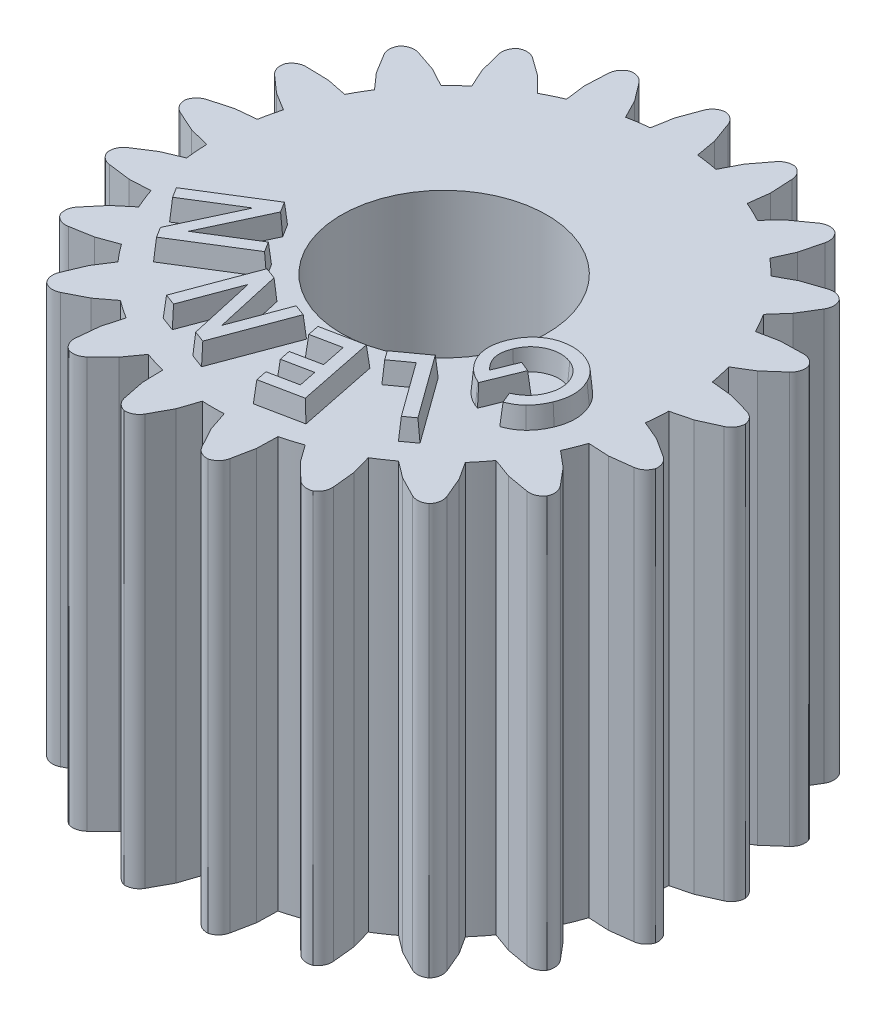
SolidWorks part; units mm, degrees
ref_plane "Front Plane" through (0, 0, 0) normal (0, 0, 1) x (1, 0, 0)
ref_plane "Top Plane" through (0, 0, 0) normal (0, 1, 0) x (1, 0, 0)
ref_plane "Right Plane" through (0, 0, 0) normal (1, 0, 0) x (0, 0, -1)
sketch "Sketch1" plane through (0, 0, 0) normal (0, 1, 0) x (1, 0, 0)
  circle A0 centre (0, 0) radius 28.575
  dimension "D1" = 57.15
extrude "Boss-Extrude1" add sketch "Sketch1" along normal blind 50.8
sketch "Sketch2" plane through (0, 50.8, 0) normal (0, 1, 0) x (1, 0, 0)
  line L0 (-2.921, 28.4253) -> (2.921, 28.4253)
  line L1 (2.921, 28.4253) -> (2.4731, 30.9653)
  line L2 (2.4731, 30.9653) -> (1.0864, 34.7753)
  line L3 (1.0864, 34.7753) -> (-1.0864, 34.7753)
  line L4 (-1.0864, 34.7753) -> (-2.4731, 30.9653)
  line L5 (-2.4731, 30.9653) -> (-2.921, 28.4253)
  circle A0 centre (0, 0) radius 28.575 construction
  dimension "D1" = 2.54
  dimension "D2" = 3.81
  dimension "D3" = 5.842
  dimension "D4" = 80
  dimension "D5" = 110
extrude "Boss-Extrude2" add sketch "Sketch2" against normal blind 50.8
fillet "Fillet1" radius 1.778 2 edges at (1.0864, 25.4, -34.7753) (-1.0864, 25.4, -34.7753)
pattern_circular "CirPattern1" count 21 over 360 about axis through (0, 0, 0) along (0, 1, 0) of "Fillet1", "Boss-Extrude2"
sketch "Sketch3" plane through (0, 50.8, 0) normal (0, 1, 0) x (1, 0, 0)
  circle A0 centre (0, 0) radius 12.7
  dimension "D1" = 25.4
extrude "Cut-Extrude1" cut sketch "Sketch3" against normal up to vertex
sketch "Sketch4" plane through (0, 50.8, 0) normal (0, 1, 0) x (1, 0, 0)
  circle A0 centre (0, 0) radius 15.875 construction
  circle A1 centre (0, 0) radius 12.7 construction
  arc A2 (-9.7016, -26.8777) -> (-7.1249, -27.6725) centre (0, 0) ccw construction
  text T0 "<b>GLENN</b>" font "Century Gothic" height 10.16
  dimension "D1" = 12.7
  dimension "D2" = 3.175
extrude "Boss-Extrude3" add sketch "Sketch4" along normal blind 2.54 draft 5
